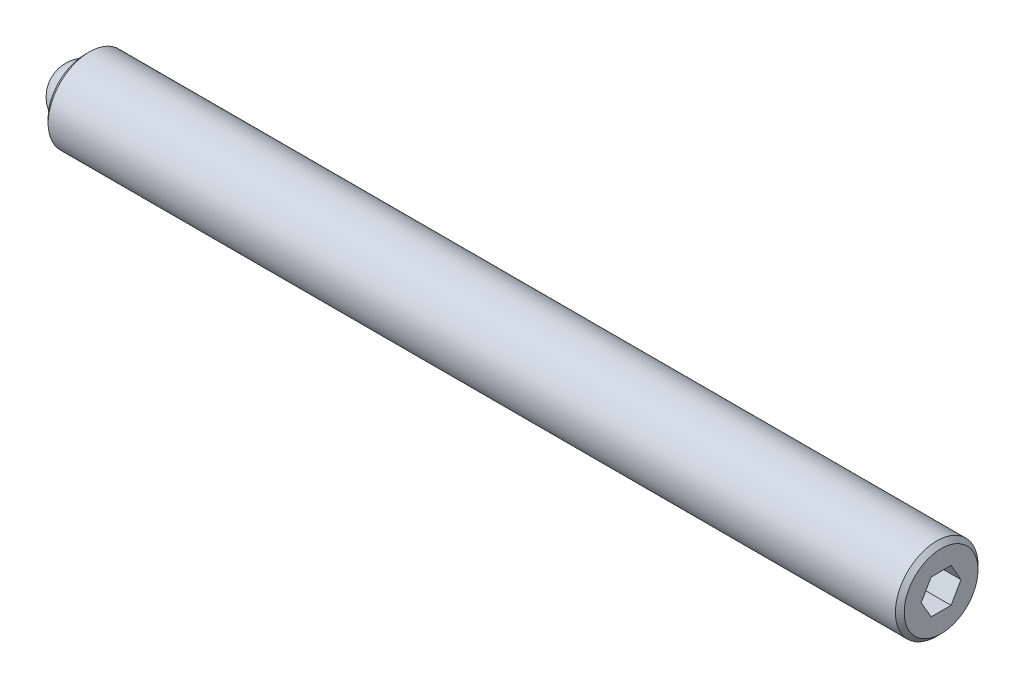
SolidWorks part; units mm, degrees
ref_plane "Front Plane" through (0, 0, 0) normal (0, 0, 1) x (1, 0, 0)
ref_plane "Top Plane" through (0, 0, 0) normal (0, 1, 0) x (1, 0, 0)
ref_plane "Right Plane" through (0, 0, 0) normal (1, 0, 0) x (0, 0, -1)
sketch "Sketch2" plane through (0, 0, 0) normal (1, 0, 0) x (0, 0, -1)
  circle A0 centre (0, 0) radius 2.3749
  dimension "D1" = 4.7498
extrude "Boss-Extrude1" add sketch "Sketch2" along normal blind 49.2125
sketch "Sketch3" plane through (0, 0, 0) normal (-1, 0, 0) x (0, 0, 1)
  circle A0 centre (0, 0) radius 1.5875
  dimension "D1" = 3.175
chamfer "Chamfer1" distance 0.254 angle 45 1 edges at (0, 0, -2.3749)
chamfer "Chamfer2" distance 0.254 angle 45 1 edges at (49.2125, 0, -2.3749)
sketch "Sketch4" plane through (49.2125, 0, 0) normal (1, 0, 0) x (0, 0, -1)
  line L1 (1.1457, 0) -> (0.5728, 0.9922)
  line L2 (0.5728, 0.9922) -> (-0.5728, 0.9922)
  line L3 (-0.5728, 0.9922) -> (-1.1457, 0)
  line L4 (-1.1457, 0) -> (-0.5728, -0.9922)
  line L5 (-0.5728, -0.9922) -> (0.5728, -0.9922)
  line L6 (0.5728, -0.9922) -> (1.1457, 0)
  circle A0 centre (0, 0) radius 0.9922 construction
extrude "Cut-Extrude2" cut sketch "Sketch4" against normal blind 2.286
extrude "Cut-Extrude3" cut sketch "Sketch3" against normal blind 1.5875
sketch "Sketch5" plane through (0, 0, 0) normal (-1, 0, 0) x (0, 0, 1)
  line L0 (0, 0) -> (0, -1.5875)
  line L1 (0, 0) -> (0, 1.5875)
  arc A0 (0, 1.5875) -> (0, -1.5875) centre (0, 0) ccw
revolve "Revolve1" add sketch "Sketch5" angle 360 about L1
sketch "Sketch6" plane through (0, 0, 0) normal (-1, 0, 0) x (0, 0, 1)
  line L0 (0, 0) -> (0, 1.5875) construction
  arc A0 (0.0635, 1.5862) -> (-0.0635, 1.5862) centre (0, 0) ccw
  circle A1 centre (0, 0) radius 1.5875 construction
  circle A3 centre (0, 0) radius 1.5875 construction
  arc A4 (0.0635, 1.5862) -> (-0.0635, 1.5862) centre (0, 1.5875) ccw
  dimension "D1" = 0.127
extrude "Cut-Extrude6" cut sketch "Sketch6" against normal blind 1.5875
